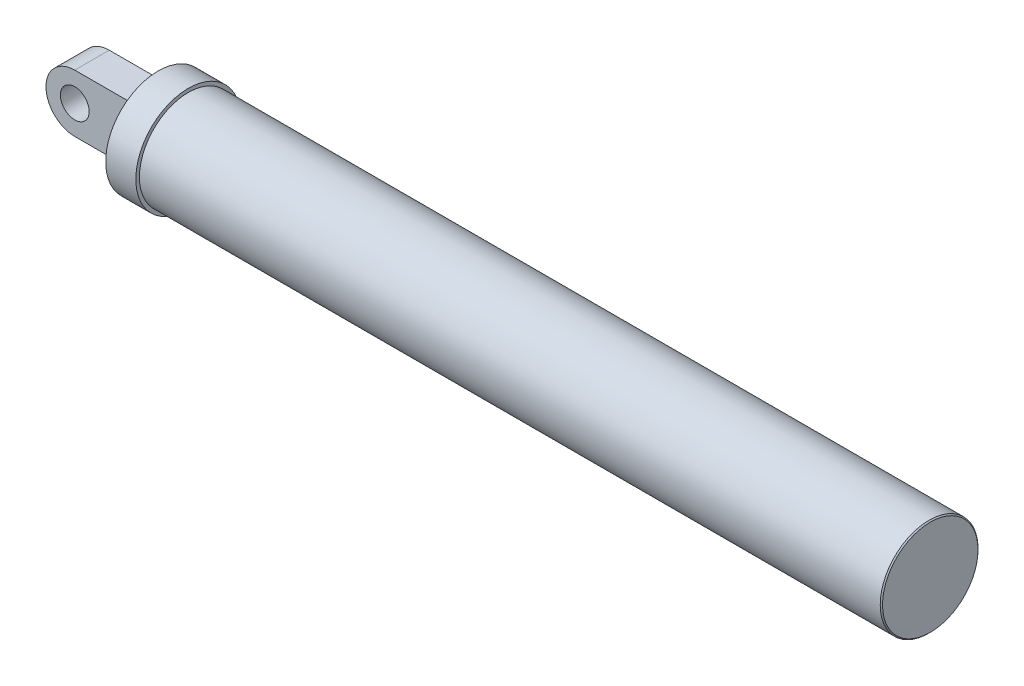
SolidWorks part; units mm, degrees
ref_plane "Face" through (0, 0, 0) normal (0, 0, 1) x (1, 0, 0)
ref_plane "Dessus" through (0, 0, 0) normal (0, 1, 0) x (1, 0, 0)
ref_plane "Droite" through (0, 0, 0) normal (1, 0, 0) x (0, 0, -1)
sketch "Esquisse1" plane through (0, 0, 0) normal (1, 0, 0) x (0, 0, -1)
  circle A0 centre (0, 0) radius 91.25
  dimension "D1" = 182.5
extrude "Extrusion1" add sketch "Esquisse1" along normal blind 52.4
sketch "Esquisse2" plane through (52.4, 0, 0) normal (1, 0, 0) x (0, 0, -1)
  circle A0 centre (0, 0) radius 85
  dimension "D1" = 170
extrude "Extrusion2" add sketch "Esquisse2" along normal blind 1290
chamfer "Chanfrein1" distance 2 angle 45 1 edges at (1342.4, 0, -85)
sketch "Esquisse3" plane through (0, 0, 0) normal (0, 0, 1) x (1, 0, 0)
  line L0 (0, 0) -> (893.9922, 0) construction
  line L1 (926.0008, 65.3) -> (1218.4, 65.3)
  line L2 (1342.4, -83) -> (1342.4, 83) construction
  line L3 (1218.4, 65.3) -> (1218.4, 70)
  line L5 (1218.4, 70) -> (12.5943, 70)
  line L6 (12.5943, 70) -> (12.5943, 0)
  line L7 (12.5943, 0) -> (926.0008, 0)
  line L8 (926.0008, 0) -> (926.0008, 65.3)
  dimension "D2" = 140
  dimension "D3" = 124
  dimension "D4" = 130.6
revolve "Enlèvement de matière-Révolution1" cut sketch "Esquisse3" angle 360 about L0
sketch "Esquisse5" plane through (0, 0, 0) normal (0, 0, 1) x (1, 0, 0)
  line L0 (-115, 50) -> (0, 50)
  line L1 (0, 91.25) -> (0, -91.25) construction
  line L2 (-115, -50) -> (0, -50)
  line L3 (0, 50) -> (0, -50)
  circle A0 centre (-115, 0) radius 25
  arc A1 (-115, 50) -> (-115, -50) centre (-115, 0) ccw
  dimension "D1" = 50
  dimension "D3" = 100
  dimension "D2" = 115
extrude "Extrusion3" add sketch "Esquisse5" along normal mid plane 60
